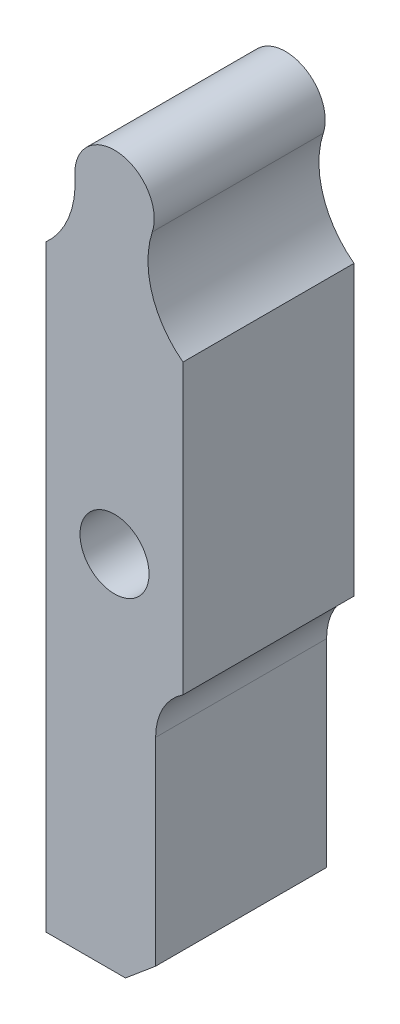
SolidWorks part; units mm, degrees
ref_plane "Front Plane" through (0, 0, 0) normal (0, 0, 1) x (1, 0, 0)
ref_plane "Top Plane" through (0, 0, 0) normal (0, 1, 0) x (1, 0, 0)
ref_plane "Right Plane" through (0, 0, 0) normal (1, 0, 0) x (0, 0, -1)
sketch "Sketch1" plane through (0, 0, 0) normal (0, 0, 1) x (1, 0, 0)
  line L0 (-7.6691, 0) -> (0, 0) construction
  line L1 (0, 0) -> (0, 31.1404) construction
  line L2 (3.175, 12.7) -> (3.175, 26.0604)
  line L3 (-3.175, 0) -> (-3.175, 27.7114)
  line L4 (-3.175, 0) -> (0.508, 0)
  line L5 (1.905, 1.1722) -> (1.905, 10.3582)
  line L6 (3.175, 0) -> (3.175, 31.1404) construction
  line L7 (-3.175, 0) -> (-3.175, 31.1404) construction
  line L8 (0.508, 0) -> (1.905, 1.1722)
  circle A0 centre (0, 16.764) radius 1.6002
  arc A1 (-1.8371, 31.0137) -> (1.7509, 30.5698) centre (0, 31.1404) cw
  arc A2 (1.905, 10.3582) -> (3.175, 12.7) centre (4.699, 10.3582) cw
  arc A3 (1.7509, 30.5698) -> (3.175, 26.0604) centre (5.6148, 29.3105) ccw
  arc A4 (-1.8371, 31.0137) -> (-3.175, 27.7114) centre (-5.8915, 30.7341) cw
  point P6 (-3.8345, 0)
  dimension "D1" = 3.2004
  dimension "D4" = 1.8415
  dimension "D7" = 1.905
  dimension "D8" = 2.794
  dimension "D10" = 4.064
  dimension "D12" = 4.064
  dimension "D2" = 16.764
  dimension "D3" = 14.3764
  dimension "D5" = 3.175
  dimension "D9" = 12.7
  dimension "D11" = 5.08
  dimension "D13" = 3.429
  dimension "D14" = 40
  dimension "D15" = 0.508
  dimension "D6" = 3.175
extrude "Boss-Extrude1" add sketch "Sketch1" along normal mid plane 7.9248
